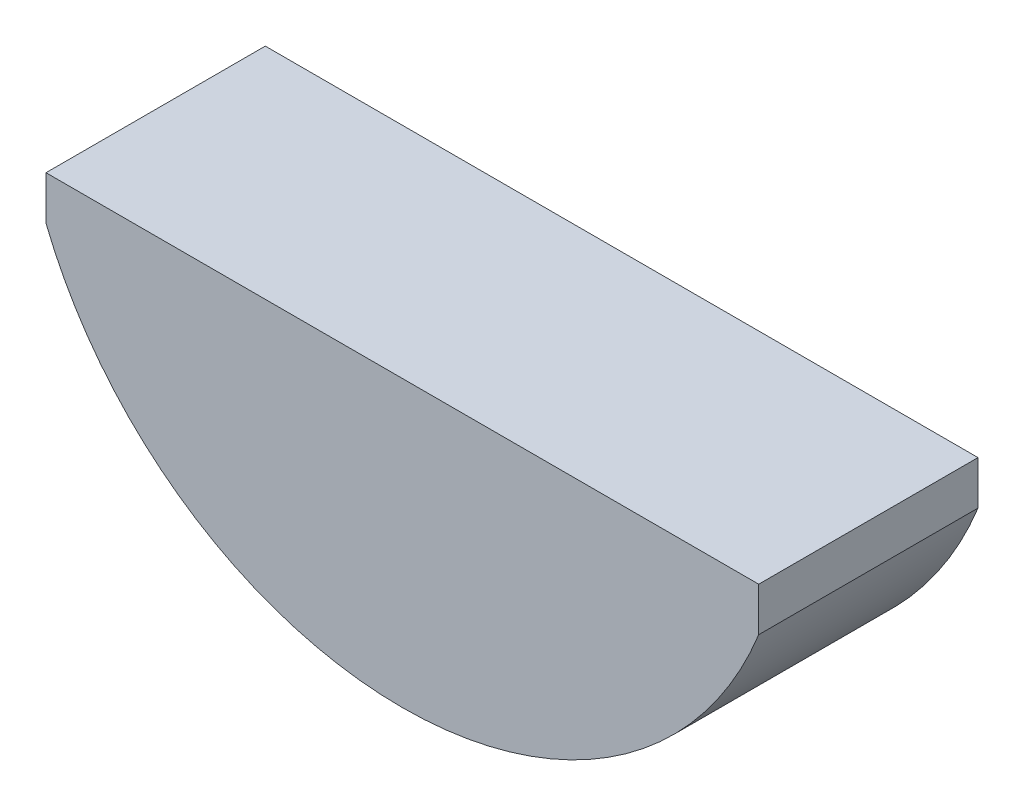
SolidWorks part; units mm, degrees
ref_plane "Plane1" through (0, 0, 0) normal (0, 0, 1) x (1, 0, 0)
ref_plane "Plane2" through (0, 0, 0) normal (0, 1, 0) x (1, 0, 0)
ref_plane "Plane3" through (0, 0, 0) normal (1, 0, 0) x (0, 0, -1)
sketch "Esquisse1" plane through (0, 0, 0) normal (0, 0, 1) x (1, 0, 0)
  line L0 (0, 0) -> (0, 11.7) construction
  line L1 (-3.25, -1.299) -> (-3.25, -0.9)
  line L2 (3.25, -1.299) -> (3.25, -0.9)
  line L3 (-3.25, -0.9) -> (3.25, -0.9)
  arc A0 (-3.25, -1.299) -> (3.25, -1.299) centre (0, 0) ccw
  dimension "D1" = 7
  dimension "D2" = 6.5
  dimension "D3" = 2.6
extrude "Base-Extrusion" add sketch "Esquisse1" along normal mid plane 2
